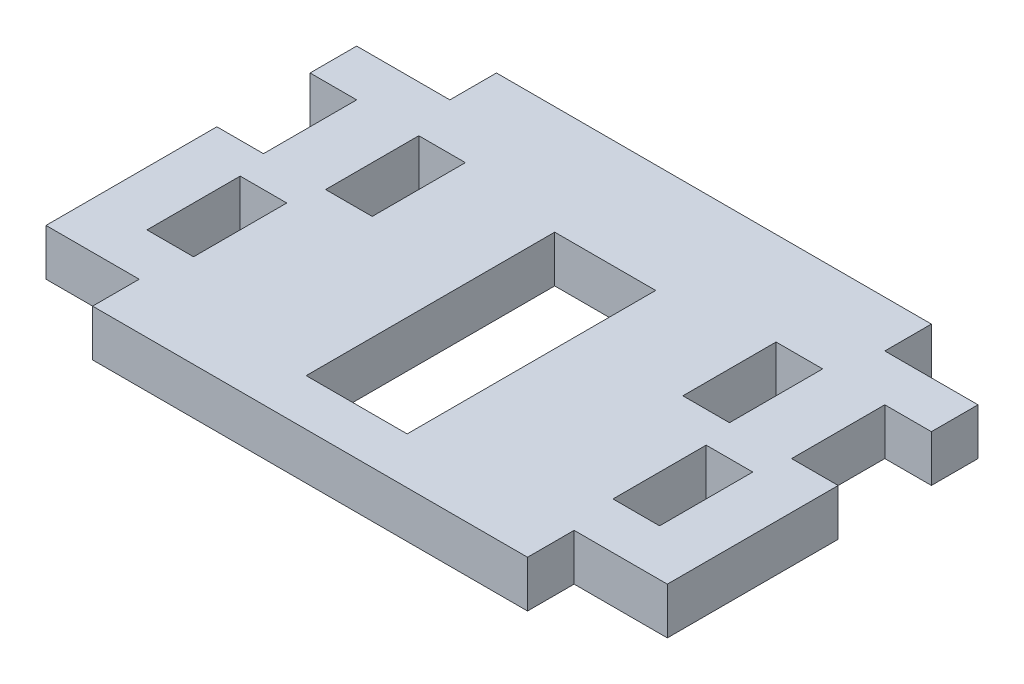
SolidWorks part; units mm, degrees
ref_plane "Front Plane" through (0, 0, 0) normal (0, 0, 1) x (1, 0, 0)
ref_plane "Top Plane" through (0, 0, 0) normal (0, 1, 0) x (1, 0, 0)
ref_plane "Right Plane" through (0, 0, 0) normal (1, 0, 0) x (0, 0, -1)
sketch "Sketch1" plane through (0, 0, 0) normal (0, 1, 0) x (1, 0, 0)
  line L1 (-20, 10) -> (20, 10)
  line L2 (-20, 10) -> (-20, -10)
  line L3 (-20, -10) -> (20, -10)
  line L4 (20, 10) -> (20, -10)
  line L5 (-20, 10) -> (20, -10) construction
  line L6 (-20, -10) -> (20, 10) construction
  point P0 (0, 0)
  dimension "D1" = 40
  dimension "D2" = 20
extrude "Boss-Extrude1" add sketch "Sketch1" along normal blind 3
sketch "Sketch2" plane through (0, 0, 0) normal (0, 1, 0) x (1, 0, 0)
  line L0 (0, 10) -> (0, 11.5) construction
  line L1 (20, 10) -> (-20, 10) construction
  line L2 (0, 0) -> (3.8865, 0) construction
  line L3 (14, -10) -> (-14, -13) construction
  line L4 (14, 13) -> (-14, 13)
  line L5 (14, 13) -> (14, 10)
  line L6 (14, 10) -> (-14, 10)
  line L7 (-14, 13) -> (-14, 10)
  line L8 (14, 13) -> (-14, 10) construction
  line L9 (14, 10) -> (-14, 13) construction
  line L10 (14, -13) -> (-14, -10) construction
  line L11 (0, -10) -> (0, -11.5) construction
  line L12 (-14, -13) -> (-14, -10)
  line L13 (14, -10) -> (-14, -10)
  line L14 (14, -13) -> (14, -10)
  line L15 (14, -13) -> (-14, -13)
  dimension "D1" = 3
  dimension "D2" = 28
extrude "Boss-Extrude2" add sketch "Sketch2" along normal blind 3
sketch "Sketch3" plane through (0, 0, 0) normal (0, 1, 0) x (1, 0, 0)
  line L1 (-3.25, 6) -> (3.25, 6)
  line L2 (-3.25, 6) -> (-3.25, -6)
  line L3 (-3.25, -6) -> (3.25, -6) construction
  line L4 (3.25, 6) -> (3.25, -6)
  line L5 (-3.25, 6) -> (3.25, -6) construction
  line L6 (-3.25, -6) -> (3.25, 6) construction
  line L7 (-3.25, -6) -> (3.25, -6) construction
  line L8 (-3.25, -6) -> (-3.25, -10)
  line L9 (-3.25, -10) -> (3.25, -10)
  line L10 (3.25, -6) -> (3.25, -10)
  point P0 (0, 0)
  dimension "D1" = 12
  dimension "D2" = 6.5
  dimension "D3" = 4
extrude "Cut-Extrude1" cut sketch "Sketch3" along normal blind 3
sketch "Sketch4" plane through (0, 0, 0) normal (0, 1, 0) x (1, 0, 0)
  line L0 (-20, 10) -> (-20, -10) construction
  line L1 (-20, 7) -> (-17, 7)
  line L2 (-20, 7) -> (-20, 1)
  line L3 (-20, 1) -> (-17, 1)
  line L4 (-17, 7) -> (-17, 1)
  line L5 (0, 0) -> (0, 3.776) construction
  line L6 (-14, 10) -> (-20, 10) construction
  line L7 (-20, -10) -> (-14, -10) construction
  line L8 (-13, 7) -> (-10, 7)
  line L9 (-13, 7) -> (-13, 1)
  line L10 (-13, 1) -> (-10, 1)
  line L11 (-10, 7) -> (-10, 1)
  line L12 (-16.5, -1) -> (-13.5, -1)
  line L13 (-16.5, -1) -> (-16.5, -7)
  line L14 (-16.5, -7) -> (-13.5, -7)
  line L15 (-13.5, -1) -> (-13.5, -7)
  line L16 (-17, 1) -> (-13, 1) construction
  line L17 (-15, 1) -> (-15, -1) construction
  line L18 (15, 1) -> (15, -1) construction
  line L19 (17, 1) -> (13, 1) construction
  line L20 (13.5, -1) -> (13.5, -7)
  line L21 (16.5, -7) -> (13.5, -7)
  line L22 (16.5, -1) -> (16.5, -7)
  line L23 (16.5, -1) -> (13.5, -1)
  line L24 (10, 7) -> (10, 1)
  line L25 (13, 1) -> (10, 1)
  line L26 (13, 7) -> (13, 1)
  line L27 (13, 7) -> (10, 7)
  line L28 (17, 7) -> (17, 1)
  line L29 (20, 1) -> (17, 1)
  line L30 (20, 7) -> (20, 1)
  line L31 (20, 7) -> (17, 7)
  dimension "D1" = 3
  dimension "D2" = 6
  dimension "D3" = 3
  dimension "D4" = 4
  dimension "D5" = 3
extrude "Cut-Extrude2" cut sketch "Sketch4" along normal blind 3
